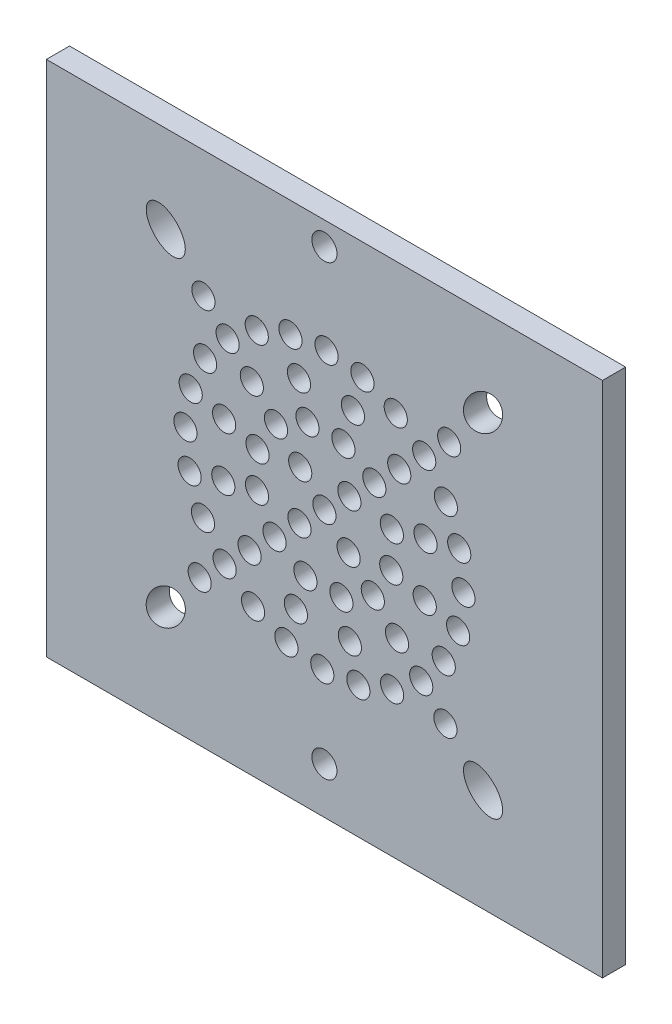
SolidWorks part; units mm, degrees
ref_plane "Alzado" through (0, 0, 0) normal (0, 0, 1) x (1, 0, 0)
ref_plane "Planta" through (0, 0, 0) normal (0, 1, 0) x (1, 0, 0)
ref_plane "Vista lateral" through (0, 0, 0) normal (1, 0, 0) x (0, 0, -1)
sketch "Croquis1" plane through (0, 0, 0) normal (0, 0, 1) x (1, 0, 0)
  line B0 (158.25, 25.0563) -> (86.25, 25.0563)
  line B1 (86.25, 25.0563) -> (86.25, -41.9437)
  line B2 (86.25, -41.9437) -> (158.25, -41.9437)
  line B3 (158.25, -41.9437) -> (158.25, 25.0563)
sketch_block_instance "Bloque-Croquis2-1"
sketch_block "Bloque-Croquis2" parameters "D1"=50, "D2"=14, "D3"=10.5
extrude "Saliente-Extruir1" add sketch "Croquis1" along normal blind 3
sketch "Croquis3" plane through (0, 0, 0) normal (0, 0, -1) x (-1, 0, 0)
  line L0 (-158.25, -8.4437) -> (-86.25, -8.4437) construction
  line L9 (-122.25, 25.0563) -> (-122.25, -41.9437) construction
  line L10 (-158.25, -41.9437) -> (-158.25, 25.0563) construction
  line L11 (-86.25, 25.0563) -> (-86.25, -41.9437) construction
  line L13 (-158.25, -7.4437) -> (-86.25, -7.4437) construction
  line L14 (-158.25, -41.9437) -> (-158.25, 25.0563) construction
  line L25 (-158.25, 25.0563) -> (-86.25, 25.0563) construction
  line L26 (-86.25, -41.9437) -> (-158.25, -41.9437) construction
  circle A0 centre (-122.25, -35.9437) radius 1.625 construction
  circle A1 centre (-122.25, 22.0563) radius 1.625 construction
  circle A2 centre (-122.25, -35.9437) radius 1.625
  circle A3 centre (-122.25, 22.0563) radius 1.625
  point P11 (-122.25, -7.4437)
  circle B0 centre (-137.9157, -23.5941) radius 1.5
  circle B1 centre (-138.4004, 8.222) radius 1.5
  circle B2 centre (-135.1703, 5.0889) radius 1.5
  circle B3 centre (-127.173, 9.87) radius 1.5
  circle B4 centre (-131.4864, 8.0059) radius 1.5
  circle B5 centre (-125.9423, 5.5416) radius 1.5
  circle B6 centre (-122.5241, 10.5542) radius 1.5
  circle B7 centre (-117.8566, 10.0119) radius 1.5
  circle B8 centre (-118.9549, 5.648) radius 1.5
  circle B9 centre (-113.4885, 8.28) radius 1.5
  circle B10 centre (-106.5843, 8.7067) radius 1.5
  circle B11 centre (-109.7174, 5.4766) radius 1.5
  circle B12 centre (-112.8506, 2.2465) radius 1.5
  circle B13 centre (-106.8004, 1.7927) radius 1.5
  circle B14 centre (-104.2521, -7.1696) radius 1.5
  circle B15 centre (-104.9363, -2.5207) radius 1.5
  circle B16 centre (-109.2647, -3.7515) radius 1.5
  circle B17 centre (-113.5932, -4.9822) radius 1.5
  circle B18 centre (-115.9837, -0.9836) radius 1.5
  circle B19 centre (-119.1169, -4.2136) radius 1.5
  circle B20 centre (-120.0533, 1.2841) radius 1.5
  circle B21 centre (-124.7115, 1.2131) radius 1.5
  circle B22 centre (-128.7101, -1.1774) radius 1.5
  circle B23 centre (-125.4801, -4.3106) radius 1.5
  circle B24 centre (-131.9402, 1.9557) radius 1.5
  circle B25 centre (-137.9737, 1.3178) radius 1.5
  circle B26 centre (-140.2479, -7.7178) radius 1.5
  circle B27 centre (-139.7056, -3.0503) radius 1.5
  circle B28 centre (-135.3417, -4.1487) radius 1.5
  circle B29 centre (-130.9778, -5.247) radius 1.5
  circle B30 centre (-130.9068, -9.9052) radius 1.5
  circle B31 centre (-122.25, -7.4437) radius 1.5
  circle B32 centre (-125.3831, -10.6738) radius 1.5
  circle B33 centre (-119.0199, -10.5769) radius 1.5
  circle B34 centre (-113.5222, -9.6404) radius 1.5
  circle B35 centre (-104.7944, -11.8371) radius 1.5
  circle B36 centre (-109.1583, -10.7388) radius 1.5
  circle B37 centre (-106.5263, -16.2052) radius 1.5
  circle B38 centre (-106.0996, -23.1095) radius 1.5
  circle B39 centre (-109.3297, -19.9763) radius 1.5
  circle B40 centre (-115.7899, -13.71) radius 1.5
  circle B41 centre (-124.4467, -16.1715) radius 1.5
  circle B42 centre (-119.7885, -16.1006) radius 1.5
  circle B43 centre (-112.5598, -16.8432) radius 1.5
  circle B44 centre (-118.5577, -20.429) radius 1.5
  circle B45 centre (-113.0136, -22.8933) radius 1.5
  circle B46 centre (-117.327, -24.7574) radius 1.5
  circle B47 centre (-121.9759, -25.4416) radius 1.5
  circle B48 centre (-125.5451, -20.5354) radius 1.5
  circle B49 centre (-128.5163, -13.9039) radius 1.5
  circle B50 centre (-131.6494, -17.1339) radius 1.5
  circle B51 centre (-135.2353, -11.136) radius 1.5
  circle B52 centre (-139.5637, -12.3667) radius 1.5
  circle B53 centre (-137.6996, -16.6801) radius 1.5
  circle B54 centre (-134.7826, -20.364) radius 1.5
  circle B55 centre (-131.0115, -23.1674) radius 1.5
  circle B56 centre (-126.6434, -24.8993) radius 1.5
  ellipse B57 centre (-142.7895, 13.7312) end of major axis (-140.7008, 11.5778) minor radius 2
  ellipse B58 centre (-101.7105, 13.7312) end of major axis (-99.6391, 15.9014) minor radius 2
  ellipse B59 centre (-101.7105, -28.6186) end of major axis (-99.6217, -30.772) minor radius 2
  ellipse B60 centre (-142.7895, -28.6186) end of major axis (-144.8783, -30.772) minor radius 2
  dimension "D1" = 1
sketch_block_instance "Bloque1-1"
sketch_block "Bloque1"
extrude "Cortar-Extruir1" cut sketch "Croquis3" against normal blind 3
